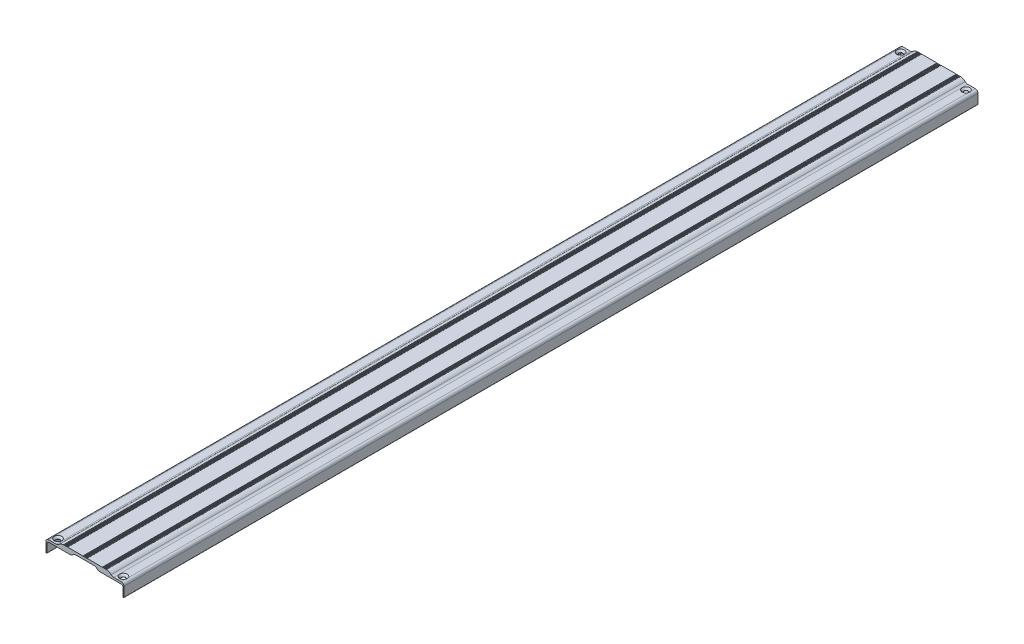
SolidWorks part; units mm, degrees
ref_plane "前视基准面" through (0, 0, 0) normal (0, 0, 1) x (1, 0, 0)
ref_plane "上视基准面" through (0, 0, 0) normal (0, 1, 0) x (1, 0, 0)
ref_plane "右视基准面" through (0, 0, 0) normal (1, 0, 0) x (0, 0, -1)
sketch "Model" plane through (0, 0, 0) normal (0, 0, 1) x (1, 0, 0)
  line L0 (84.8493, 20.0085) -> (93.5598, 20.0085)
  line L1 (66.0046, 19.0756) -> (66.1151, 18.9714)
  line L2 (35.3737, 17.6085) -> (11.4598, 17.6085)
  line L3 (95.4598, 6.2085) -> (95.4598, 15.6085)
  line L4 (96.5598, 17.0085) -> (96.5598, 6.2085)
  line L5 (54.8697, 23.5085) -> (72.0499, 23.5085)
  line L6 (32.8697, 23.5085) -> (50.0499, 23.5085)
  line L7 (11.3598, 20.0085) -> (20.0704, 20.0085)
  line L8 (8.3598, 6.2085) -> (8.3598, 17.0085)
  line L9 (9.4598, 15.6085) -> (9.4598, 6.2085)
  line L10 (38.8046, 18.9714) -> (38.9151, 19.0756)
  line L11 (62.5737, 20.4384) -> (42.3459, 20.4384)
  line L12 (69.5459, 17.6085) -> (93.4598, 17.6085)
  line L13 (8.9598, 5.7085) -> (8.8598, 5.7085)
  line L14 (96.0598, 5.7085) -> (95.9598, 5.7085)
  line L15 (76.0499, 23.5085) -> (75.8697, 23.5085)
  line L16 (29.0499, 23.5085) -> (28.8697, 23.5085)
  line L17 (54.0499, 23.5085) -> (53.8697, 23.5085)
  line L18 (73.0499, 23.5085) -> (72.8697, 23.5085)
  line L19 (51.0499, 23.5085) -> (50.8697, 23.5085)
  line L20 (32.0499, 23.5085) -> (31.8697, 23.5085)
  line L21 (75.0499, 23.5085) -> (74.8697, 23.5085)
  line L22 (30.0499, 23.5085) -> (29.8697, 23.5085)
  line L23 (53.0499, 23.5085) -> (52.8697, 23.5085)
  line L24 (74.0499, 23.5085) -> (73.8697, 23.5085)
  line L25 (52.0499, 23.5085) -> (51.8697, 23.5085)
  line L26 (31.0499, 23.5085) -> (30.8697, 23.5085)
  arc A0 (82.0258, 21.1752) -> (84.8493, 20.0085) centre (84.8493, 24.0085) ccw
  arc A1 (96.5598, 17.0085) -> (93.5598, 20.0085) centre (93.5598, 17.0085) ccw
  arc A2 (35.3737, 17.6085) -> (38.8046, 18.9714) centre (35.3737, 22.6085) ccw
  arc A3 (42.3459, 20.4384) -> (38.9151, 19.0756) centre (42.3459, 15.4384) ccw
  arc A4 (95.4598, 15.6085) -> (93.4598, 17.6085) centre (93.4598, 15.6085) ccw
  arc A5 (28.1201, 23.4975) -> (22.8939, 21.1752) centre (28.5409, 15.5085) ccw
  arc A6 (20.0704, 20.0085) -> (22.8939, 21.1752) centre (20.0704, 24.0085) ccw
  arc A7 (66.1151, 18.9714) -> (69.5459, 17.6085) centre (69.5459, 22.6085) ccw
  arc A8 (66.0046, 19.0756) -> (62.5737, 20.4384) centre (62.5737, 15.4384) ccw
  arc A9 (72.1445, 23.4624) -> (72.0499, 23.5085) centre (72.0499, 23.3885) ccw
  arc A10 (50.1445, 23.4624) -> (50.0499, 23.5085) centre (50.0499, 23.3885) ccw
  arc A11 (32.8697, 23.5085) -> (32.7751, 23.4624) centre (32.8697, 23.3885) ccw
  arc A12 (28.1201, 23.4975) -> (28.7751, 23.4624) centre (28.4598, 23.7085) ccw
  arc A13 (82.0258, 21.1752) -> (76.7996, 23.4975) centre (76.3788, 15.5085) ccw
  arc A14 (8.3598, 6.2085) -> (8.8598, 5.7085) centre (8.8598, 6.2085) ccw
  arc A15 (8.9598, 5.7085) -> (9.4598, 6.2085) centre (8.9598, 6.2085) ccw
  arc A16 (11.3598, 20.0085) -> (8.3598, 17.0085) centre (11.3598, 17.0085) ccw
  arc A17 (11.4598, 17.6085) -> (9.4598, 15.6085) centre (11.4598, 15.6085) ccw
  arc A18 (95.4598, 6.2085) -> (95.9598, 5.7085) centre (95.9598, 6.2085) ccw
  arc A19 (96.0598, 5.7085) -> (96.5598, 6.2085) centre (96.0598, 6.2085) ccw
  arc A20 (76.1445, 23.4624) -> (76.0499, 23.5085) centre (76.0499, 23.3885) ccw
  arc A21 (54.1445, 23.4624) -> (54.7751, 23.4624) centre (54.4598, 23.7085) ccw
  arc A22 (72.1445, 23.4624) -> (72.7751, 23.4624) centre (72.4598, 23.7085) ccw
  arc A23 (50.1445, 23.4624) -> (50.7751, 23.4624) centre (50.4598, 23.7085) ccw
  arc A24 (32.1445, 23.4624) -> (32.7751, 23.4624) centre (32.4598, 23.7085) ccw
  arc A25 (28.8697, 23.5085) -> (28.7751, 23.4624) centre (28.8697, 23.3885) ccw
  arc A26 (76.1445, 23.4624) -> (76.7996, 23.4975) centre (76.4598, 23.7085) ccw
  arc A27 (54.8697, 23.5085) -> (54.7751, 23.4624) centre (54.8697, 23.3885) ccw
  arc A28 (54.1445, 23.4624) -> (54.0499, 23.5085) centre (54.0499, 23.3885) ccw
  arc A29 (72.8697, 23.5085) -> (72.7751, 23.4624) centre (72.8697, 23.3885) ccw
  arc A30 (50.8697, 23.5085) -> (50.7751, 23.4624) centre (50.8697, 23.3885) ccw
  arc A31 (32.1445, 23.4624) -> (32.0499, 23.5085) centre (32.0499, 23.3885) ccw
  arc A32 (75.8697, 23.5085) -> (75.7751, 23.4624) centre (75.8697, 23.3885) ccw
  arc A33 (29.1445, 23.4624) -> (29.0499, 23.5085) centre (29.0499, 23.3885) ccw
  arc A34 (75.1445, 23.4624) -> (75.7751, 23.4624) centre (75.4598, 23.7085) ccw
  arc A35 (53.8697, 23.5085) -> (53.7751, 23.4624) centre (53.8697, 23.3885) ccw
  arc A36 (73.1445, 23.4624) -> (73.0499, 23.5085) centre (73.0499, 23.3885) ccw
  arc A37 (51.1445, 23.4624) -> (51.0499, 23.5085) centre (51.0499, 23.3885) ccw
  arc A38 (31.8697, 23.5085) -> (31.7751, 23.4624) centre (31.8697, 23.3885) ccw
  arc A39 (29.1445, 23.4624) -> (29.7751, 23.4624) centre (29.4598, 23.7085) ccw
  arc A40 (75.1445, 23.4624) -> (75.0499, 23.5085) centre (75.0499, 23.3885) ccw
  arc A41 (53.1445, 23.4624) -> (53.7751, 23.4624) centre (53.4598, 23.7085) ccw
  arc A42 (73.1445, 23.4624) -> (73.7751, 23.4624) centre (73.4598, 23.7085) ccw
  arc A43 (51.1445, 23.4624) -> (51.7751, 23.4624) centre (51.4598, 23.7085) ccw
  arc A44 (31.1445, 23.4624) -> (31.7751, 23.4624) centre (31.4598, 23.7085) ccw
  arc A45 (29.8697, 23.5085) -> (29.7751, 23.4624) centre (29.8697, 23.3885) ccw
  arc A46 (53.1445, 23.4624) -> (53.0499, 23.5085) centre (53.0499, 23.3885) ccw
  arc A47 (73.8697, 23.5085) -> (73.7751, 23.4624) centre (73.8697, 23.3885) ccw
  arc A48 (51.8697, 23.5085) -> (51.7751, 23.4624) centre (51.8697, 23.3885) ccw
  arc A49 (31.1445, 23.4624) -> (31.0499, 23.5085) centre (31.0499, 23.3885) ccw
  arc A50 (74.8697, 23.5085) -> (74.7751, 23.4624) centre (74.8697, 23.3885) ccw
  arc A51 (30.1445, 23.4624) -> (30.0499, 23.5085) centre (30.0499, 23.3885) ccw
  arc A52 (74.1445, 23.4624) -> (74.7751, 23.4624) centre (74.4598, 23.7085) ccw
  arc A53 (52.8697, 23.5085) -> (52.7751, 23.4624) centre (52.8697, 23.3885) ccw
  arc A54 (74.1445, 23.4624) -> (74.0499, 23.5085) centre (74.0499, 23.3885) ccw
  arc A55 (52.1445, 23.4624) -> (52.0499, 23.5085) centre (52.0499, 23.3885) ccw
  arc A56 (30.8697, 23.5085) -> (30.7751, 23.4624) centre (30.8697, 23.3885) ccw
  arc A57 (30.1445, 23.4624) -> (30.7751, 23.4624) centre (30.4598, 23.7085) ccw
  arc A58 (52.1445, 23.4624) -> (52.7751, 23.4624) centre (52.4598, 23.7085) ccw
extrude "凸台-拉伸1" add sketch "Model" along normal mid plane 966
hole_wizard "打孔尺寸(%根据十字)槽半沉头木螺钉的类型1" positions "草图2" profile "草图3" countersink size "M4" standard "GB"
sketch "草图2" plane through (0, 20.0085, 0) normal (0, 1, 0) x (1, 0, 0)
  line L0 (52.4598, 483) -> (52.4598, -315.1766) construction
  line L1 (52.7751, 483) -> (52.1445, 483) construction
  line L3 (20.0704, -483) -> (11.3598, -483) construction
  line L4 (20.0704, 483) -> (11.3598, 483) construction
  point P0 (15.4598, 476.5)
  point P2 (89.4598, 476.5)
  point P4 (15.4598, -476.5)
  point P6 (89.4598, -476.5)
  dimension "D1" = 74
  dimension "D2" = 6.5
  dimension "D3" = 6.5
sketch "草图3" plane through (15.4598, 20.0085, -476.5) normal (1, 0, 0) x (0, 0, 1)
  line L0 (0, 0) -> (0, 14.3)
  line L1 (0, 14.3) -> (2.25, 14.3)
  line L2 (2.25, 14.3) -> (2.25, 2.05)
  line L3 (2.25, 2.05) -> (4.3, 0)
  line L5 (4.3, 0) -> (0, 0)
  line L6 (-2.25, 2.05) -> (-4.3, 0) construction
  line L11 (0, -6.35) -> (0, 107.95) construction
  dimension "通孔孔直径" = 4.5
  dimension "通孔孔深度" = 14.3
  dimension "近端锥形沉头孔直径" = 8.6
  dimension "近端锥形沉头孔角度" = 90
